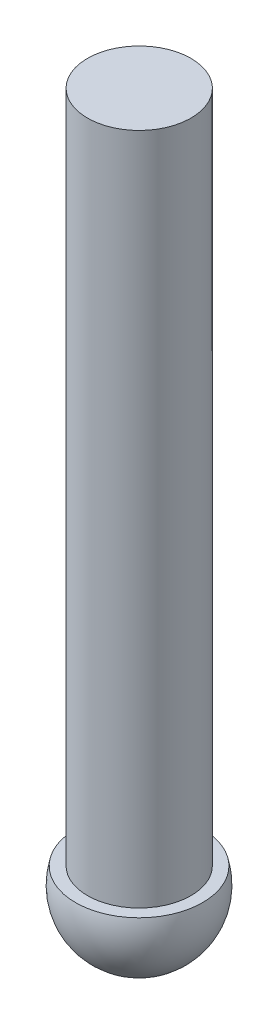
SolidWorks part; units mm, degrees
ref_plane "Front Plane" through (0, 0, 0) normal (0, 0, 1) x (1, 0, 0)
ref_plane "Top Plane" through (0, 0, 0) normal (0, 1, 0) x (1, 0, 0)
ref_plane "Right Plane" through (0, 0, 0) normal (1, 0, 0) x (0, 0, -1)
ref_plane "Plane1" through (-44.5895, 252.8795, 0) normal (0.1736, -0.9848, 0) x (0.9848, 0.1736, 0)
sketch "Sketch1" plane through (-2935.0159, 0, 0) normal (0, 1, 0) x (-1, 0, 0)
  line L0 (-2935.0159, 46.0801) -> (-2935.0159, -46.0801) construction
  circle A0 centre (-2935.0159, -0.05) radius 15
extrude "Extrude1" add sketch "Sketch1" against normal blind 200
sketch "Sketch2" plane through (0, 0, 0) normal (0, 0, 1) x (1, 0, 0)
  line L0 (0, -234.3111) -> (0, 234.3111) construction
  line L5 (-15, -200) -> (15, -200) construction
  line L6 (0, -195.1765) -> (0, -219.05)
  line L7 (18.4292, -195.1765) -> (0, -195.1765)
  arc A0 (0, -219.05) -> (18.4292, -195.1765) centre (0, -200) ccw
  dimension "D1" = 38.1
revolve "Revolve1" add sketch "Sketch2" angle 360 about L0
sketch "Sketch4" plane through (0, -195.1765, 0) normal (0, 1, 0) x (-1, 0, 0)
  line L1 (0, 0) -> (32.935, 0)
  line L2 (0, 0) -> (0, -64.732)
  line L3 (0, -64.732) -> (32.935, -64.732)
  line L4 (32.935, 0) -> (32.935, -64.732)
